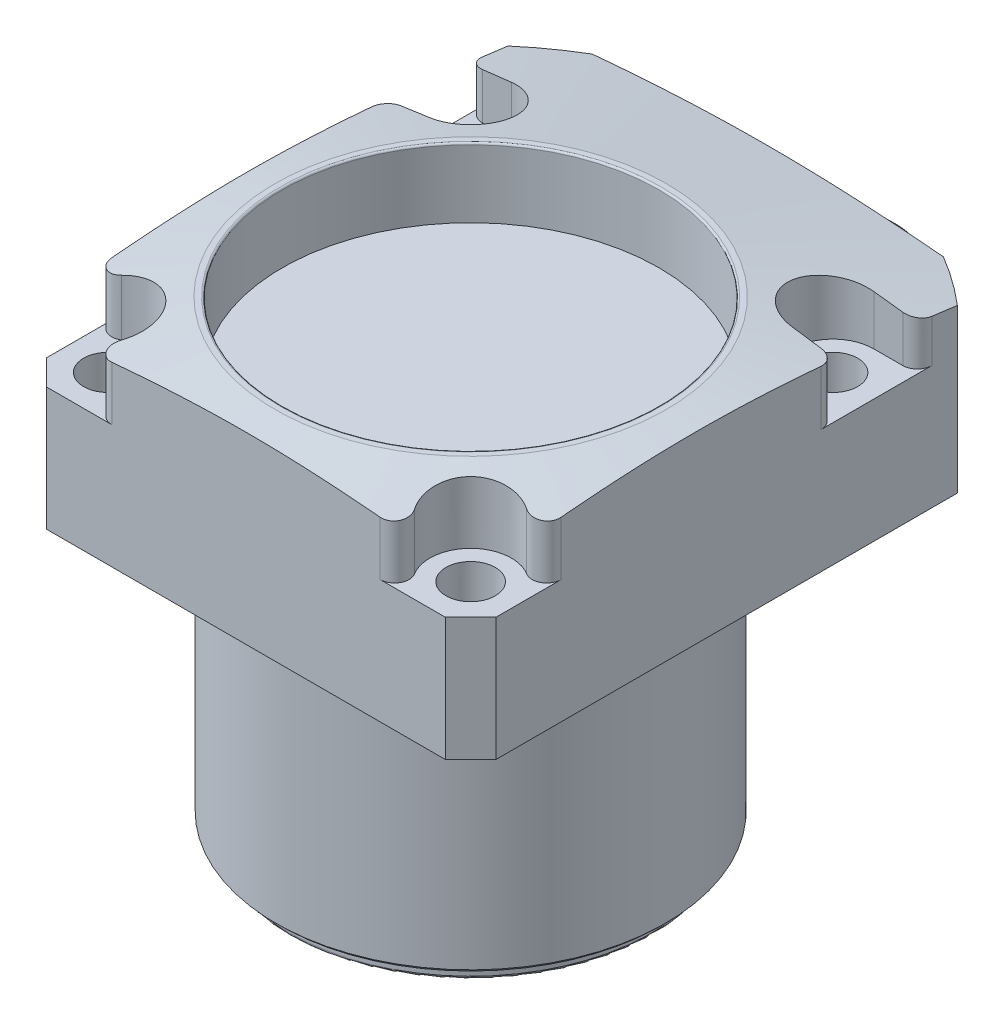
SolidWorks part; units mm, degrees
ref_plane "Front Plane" through (0, 0, 0) normal (0, 0, 1) x (1, 0, 0)
ref_plane "Top Plane" through (0, 0, 0) normal (0, 1, 0) x (1, 0, 0)
ref_plane "Right Plane" through (0, 0, 0) normal (1, 0, 0) x (0, 0, -1)
sketch "Sketch6" plane through (0, 0, 0) normal (0, 0, 1) x (1, 0, 0)
  line L0 (0, -8.9689) -> (0, 71.3762) construction
  line L1 (26, 26.06) -> (27, 26.06)
  line L2 (27, 26.06) -> (47.625, 22.4233)
  line L3 (47.625, 22.4233) -> (47.625, 0)
  line L4 (47.625, 0) -> (26.885, 0)
  line L5 (26.885, 0) -> (26.885, -35.88)
  line L6 (26.885, -35.88) -> (0, -35.88)
  line L7 (0, -35.88) -> (0, 16.5)
  line L8 (26, 26.06) -> (26, 16.5)
  line L9 (26, 16.5) -> (0, 16.5)
  dimension "D1" = 53.77
  dimension "D2" = 26.06
  dimension "D3" = 35.88
  dimension "D4" = 95.25
  dimension "D5" = 10
  dimension "D6" = 54
  dimension "D7" = 9.56
  dimension "D8" = 52
revolve "Revolve3" add sketch "Sketch6" angle 360 about L0
fillet "Fillet7" radius 0.25 1 edges at (0, 26.06, -26)
sketch "Sketch7" plane through (0, 0, 0) normal (0, -1, 0) x (1, 0, 0)
  line L0 (0, 0) -> (0, -52.3237) construction
  line L1 (-31, 31) -> (31, 31)
  line L2 (-31, 31) -> (-31, -41)
  line L3 (-31, -41) -> (31, -41)
  line L4 (31, 31) -> (31, -41)
  dimension "D1" = 62
  dimension "D2" = 72
  dimension "D3" = 31
extrude "Cut-Extrude5" cut sketch "Sketch7" against normal through all flip side to cut
sketch "Sketch8" plane through (0, 0, 0) normal (0, -1, 0) x (1, 0, 0)
  circle A0 centre (-25, 25) radius 3.4
  dimension "D1" = 6.8
  dimension "D2" = 25
  dimension "D3" = 25
extrude "Cut-Extrude6" cut sketch "Sketch8" against normal through all
pattern_circular "CirPattern2" count 4 over 360 about axis through (0, 0, 0) along (0, 1, 0) of "Cut-Extrude6"
chamfer "Chamfer1" distance 3.5 angle 45 2 edges at (-31, 11.5453, 31) (31, 11.5453, 31)
sketch "Sketch9" plane through (0, 26.06, 0) normal (0, 1, 0) x (1, 0, 0)
  line L0 (-31, -27.5) -> (-27.5, -31) construction
  line L1 (-27.5, -31) -> (27.5, -31) construction
  line L2 (31, 30.625) -> (31, 19.375)
  line L3 (-31, -27.5) -> (-27.5, -31)
  line L4 (31, 19.375) -> (25, 19.375)
  line L5 (25, 30.625) -> (31, 30.625)
  line L6 (-25, 30.625) -> (-31, 30.625)
  line L7 (-31, 36.1544) -> (-31, -27.5) construction
  line L8 (-31, 19.375) -> (-25, 19.375)
  line L9 (-31, 30.625) -> (-31, 19.375)
  line L10 (-27.5, -31) -> (-23.045, -31)
  line L11 (0, 0) -> (0, 26.6366) construction
  line L13 (-31, -23.045) -> (-28.9775, -21.0225)
  line L14 (-21.0225, -28.9775) -> (-23.045, -31)
  line L15 (-31, -23.045) -> (-31, -27.5)
  line L16 (31, -23.045) -> (31, -27.5)
  line L17 (21.0225, -28.9775) -> (23.045, -31)
  line L18 (31, -23.045) -> (28.9775, -21.0225)
  line L19 (27.5, -31) -> (23.045, -31)
  line L20 (31, -27.5) -> (27.5, -31)
  arc A0 (-21.0225, -28.9775) -> (-28.9775, -21.0225) centre (-25, -25) ccw
  arc A1 (-25, 19.375) -> (-25, 30.625) centre (-25, 25) ccw
  arc A2 (21.0225, -28.9775) -> (28.9775, -21.0225) centre (25, -25) cw
  arc A3 (25, 19.375) -> (25, 30.625) centre (25, 25) cw
  dimension "D1" = 11.25
extrude "Cut-Extrude7" cut sketch "Sketch9" against normal offset from surface (9.06 mm away) 17
fillet "Fillet4" radius 2 8 edges at (-31, 20.6875, -19.375) (31, 20.0686, -30.625) (31, 20.6875, -19.375) (31, 20.5049, 23.045) (23.045, 20.5049, 31) (-23.045, 20.5049, 31) (-31, 20.5049, 23.045) (-31, 20.0686, -30.625)
fillet "Fillet5" radius 0.4 1 edges at (0, 0, -26.885)
sketch "Sketch17" plane through (0, 0, 0) normal (0, 0, 1) x (1, 0, 0)
  line L0 (0, 0) -> (0, -34.4902) construction
  line L1 (-26.885, -35.88) -> (26.885, -35.88) construction
  line L2 (-24.6, -35.88) -> (0, -35.88)
  line L3 (-25, -36.28) -> (-25, -37.48)
  line L4 (-24.6, -37.88) -> (0, -37.88)
  line L5 (0, -35.88) -> (0, -37.88)
  arc A0 (-25, -37.48) -> (-24.6, -37.88) centre (-24.6, -37.48) ccw
  arc A1 (-24.6, -35.88) -> (-25, -36.28) centre (-24.6, -36.28) ccw
  point P11 (-25, -37.88)
  point P14 (-25, -35.88)
  dimension "D3" = 0.4
  dimension "D1" = 2
  dimension "D2" = 50
revolve "Revolve8" add sketch "Sketch17" angle 360 about L0
chamfer "Chamfer2" distance 0.5 angle 45 1 edges at (0, -35.88, -26.885)
ref_plane "Plane1" through (0, 13, 0) normal (0, -1, 0) x (1, 0, 0)
sketch "Sketch11" plane through (0, 13, 0) normal (0, -1, 0) x (1, 0, 0)
  line L0 (-14, -4.7006) -> (-14, -58.3255) construction
  line L1 (-24.231, -41) -> (24.231, -41) construction
  line L10 (-14, -41) -> (-22.25, -41)
  line L11 (-14, -25.59) -> (-14, -41)
  line L12 (-18.42, -25.59) -> (-14, -25.59)
  line L13 (-18.42, -40.17) -> (-18.42, -25.59)
  line L14 (-19, -40.75) -> (-18.42, -40.17)
  line L15 (-22.25, -40.75) -> (-19, -40.75)
  line L16 (-22.25, -41) -> (-22.25, -40.75)
  dimension "D1" = 14
  dimension "D2" = 0.25
  dimension "D3" = 15.16
  dimension "D4" = 8.84
  dimension "D5" = 16.5
  dimension "D6" = 45
  dimension "D7" = 0.58
revolve "Cut-Revolve5" cut sketch "Sketch11" angle 360 about L0
ref_plane "Plane2" through (0, 0, -33) normal (0, 0, 1) x (1, 0, 0)
sketch "Sketch13" plane through (0, 0, -33) normal (0, 0, 1) x (1, 0, 0)
  line L0 (-16.5, 12) -> (-16.5, 2.875)
  line L1 (-16.5, 2.875) -> (-17.125, 2.25)
  line L2 (-17.125, 2.25) -> (-19, 2.25)
  line L3 (-19, 2.25) -> (-19, 0)
  line L4 (-27.285, 0) -> (27.285, 0) construction
  line L5 (-19, 0) -> (-14, 0)
  line L6 (-14, 0) -> (-14, 12)
  line L7 (-14, 12) -> (-16.5, 12)
  line L8 (-14, 15.2099) -> (-14, -4.3918) construction
  dimension "D1" = 14
  dimension "D2" = 5
  dimension "D3" = 12
  dimension "D4" = 2.25
  dimension "D5" = 10
  dimension "D6" = 45
  dimension "D7" = 0.625
revolve "Cut-Revolve6" cut sketch "Sketch13" angle 360 about L8
sketch "Sketch14" plane through (0, 13, 0) normal (0, -1, 0) x (1, 0, 0)
  line L0 (-14, -33) -> (-14, 43.3353) construction
  line L14 (-18.125, -37.3078) -> (-18.125, -40.75)
  line L15 (-18.125, -40.75) -> (-21, -40.75)
  line L16 (-21, -40.75) -> (-21, -44.81)
  line L17 (-21, -44.81) -> (-16.5, -44.81)
  line L18 (-16.5, -44.81) -> (-16.5, -38.811)
  line L19 (-16.5, -38.811) -> (-14, -37.3088)
  line L20 (-14, -37.3088) -> (-14, -37.3078)
  line L21 (-14, -37.3078) -> (-18.125, -37.3078)
  line L22 (-22.25, -40.75) -> (-5.75, -40.75) construction
  dimension "D12" = 14
  dimension "D13" = 4.06
  dimension "D14" = 5
  dimension "D15" = 8.25
  dimension "D16" = 3.4422
  dimension "D17" = 59
  dimension "D18" = 0.001
revolve "Revolve6" add sketch "Sketch14" angle 360 about L0
chamfer "Chamfer3" distance 0.4 angle 45 1 edges at (-16.5, 13, -44.81)
chamfer "Chamfer4" distance 0.75 angle 45 1 edges at (-21, 13, -44.81)
sketch "Sketch15" plane through (0, 0, -44.81) normal (0, 0, 1) x (1, 0, 0)
  line L1 (-11.5, 11.5566) -> (-11.5, 14.4434)
  line L2 (-11.5, 14.4434) -> (-14, 15.8868)
  line L3 (-14, 15.8868) -> (-16.5, 14.4434)
  line L4 (-16.5, 14.4434) -> (-16.5, 11.5566)
  line L5 (-16.5, 11.5566) -> (-14, 10.1132)
  line L6 (-14, 10.1132) -> (-11.5, 11.5566)
  circle A0 centre (-14, 13) radius 2.5 construction
  circle A1 centre (-14, 13) radius 2.5 construction
  dimension "D1" = 5
extrude "Cut-Extrude8" cut sketch "Sketch15" along normal blind 5
mirror "Mirror4" about plane through (0, 0, 0) normal (1, 0, 0) of "Chamfer4", "Chamfer3", "Cut-Revolve5", "Cut-Revolve6", "Revolve6", "Cut-Extrude8"
sketch "Sketch16" plane through (0, 0, -33) normal (0, 0, 1) x (1, 0, 0)
  line L1 (-14, 9.3219) -> (-14, -15.1063) construction
  line L2 (-14, 2.875) -> (-14, 9.3549) construction
  line L3 (27.5, 0) -> (-27.5, 0) construction
  circle A0 centre (-17.5, 0.75) radius 1.5
  dimension "D1" = 3
  dimension "D3" = 0.75
  dimension "D2" = 7
revolve "Revolve7" add sketch "Sketch16" angle 360 about L1
mirror "Mirror3" about plane through (0, 0, 0) normal (1, 0, 0)
